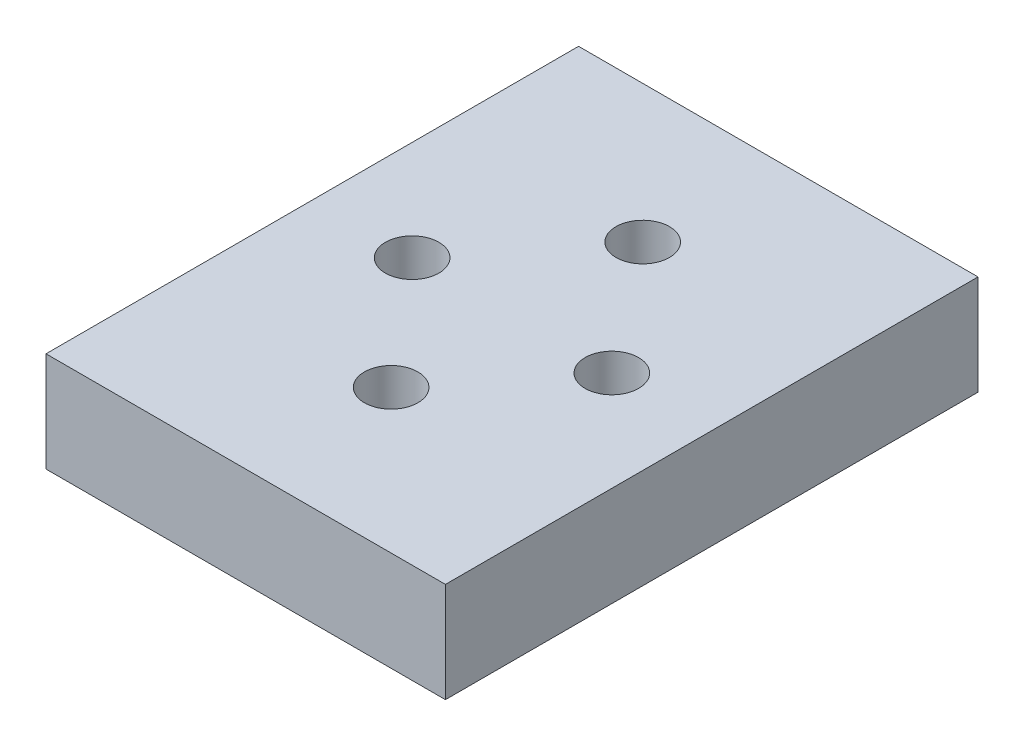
SolidWorks part; units mm, degrees
ref_plane "Front Plane" through (0, 0, 0) normal (0, 0, 1) x (1, 0, 0)
ref_plane "Top Plane" through (0, 0, 0) normal (0, 1, 0) x (1, 0, 0)
ref_plane "Right Plane" through (0, 0, 0) normal (1, 0, 0) x (0, 0, -1)
sketch "Sketch1" plane through (0, 0, 0) normal (0, 1, 0) x (1, 0, 0)
  line L1 (-19.05, 25.4) -> (19.05, 25.4)
  line L2 (-19.05, 25.4) -> (-19.05, -25.4)
  line L3 (-19.05, -25.4) -> (19.05, -25.4)
  line L4 (19.05, 25.4) -> (19.05, -25.4)
  line L5 (-19.05, 25.4) -> (19.05, -25.4) construction
  line L6 (-19.05, -25.4) -> (19.05, 25.4) construction
  point P0 (0, 0)
  dimension "D1" = 38.1
  dimension "D2" = 50.8
extrude "Boss-Extrude1" add sketch "Sketch1" along normal mid plane 9.525
hole_wizard "CBORE for #10 Socket Head Cap Screw1" positions "Sketch4" profile "Sketch5" counterbore size "#10" standard "ANSI Inch"
sketch "Sketch4" plane through (0, -4.7625, 0) normal (0, -1, 0) x (-1, 0, 0)
  line L0 (0, -25.4) -> (0, -36.9306) construction
  line L1 (19.05, -25.4) -> (-19.05, -25.4) construction
  line L3 (-9.525, 0) -> (-19.05, 0) construction
  line L4 (-19.05, -25.4) -> (-19.05, 25.4) construction
  point P0 (-9.525, 0)
  point P2 (9.525, 0)
  dimension "D1" = 9.525
sketch "Sketch5" plane through (9.525, -4.7625, 0) normal (1, 0, 0) x (0, 0, -1)
  line L0 (0, 0) -> (0, 9.525)
  line L1 (0, 9.525) -> (2.5527, 9.525)
  line L3 (2.5527, 9.525) -> (2.5527, 4.826)
  line L4 (2.5527, 4.826) -> (4.7625, 4.826)
  line L5 (4.7625, 4.826) -> (4.7625, 0)
  line L7 (4.7625, 0) -> (0, 0)
  line L11 (0, -6.35) -> (0, 107.95) construction
  dimension "Thru Hole Dia." = 5.1054
  dimension "Thru Hole Depth" = 9.525
  dimension "C'Bore Dia." = 9.525
  dimension "C'Bore Depth" = 4.826
chamfer "Chamfer1" [suppressed] distance 4.7625 angle 45
hole_wizard "1/4-20 Tapped Hole1" positions "Sketch6" profile "Sketch8" tap size "1/4-20" standard "ANSI Inch"
sketch "Sketch6" plane through (0, -4.7625, 0) normal (0, -1, 0) x (-1, 0, 0)
  point P0 (-0.1814, -11.7111)
  point P3 (-0.1814, 12.2889)
sketch "Sketch8" plane through (0.1814, -4.7625, 11.7111) normal (1, 0, 0) x (0, 0, -1)
  line L0 (0, 0) -> (0, 9.525)
  line L1 (0, 9.525) -> (2.5527, 9.525)
  line L2 (2.5527, 9.525) -> (2.5527, 0)
  line L5 (2.5527, 0) -> (0, 0)
  line L11 (0, -6.35) -> (0, 107.95) construction
  dimension "Thru Tap Drill Dia." = 5.1054
  dimension "Thru Tap Drill Depth" = 9.525
